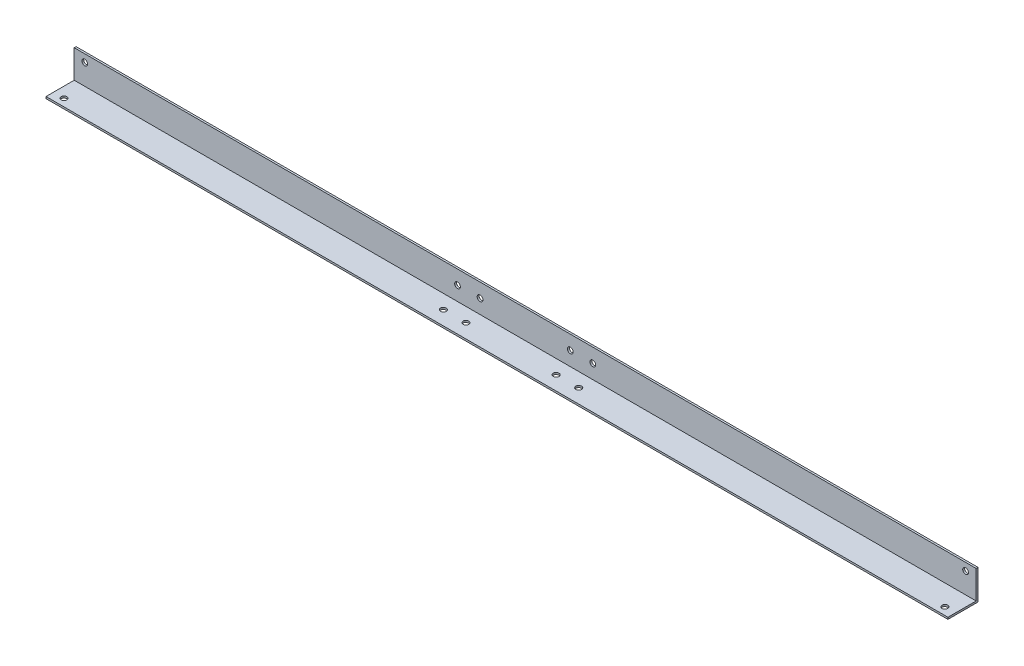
SolidWorks part; units mm, degrees
ref_plane "Front Plane" through (0, 0, 0) normal (1, 0, 0) x (0, 1, 0)
ref_plane "Top Plane" through (0, 0, 0) normal (0, 0, 1) x (0, 1, 0)
ref_plane "Right Plane" through (0, 0, 0) normal (0, 1, 0) x (-1, 0, 0)
sketch "Sketch1" plane through (0, 0, 0) normal (1, 0, 0) x (0, 1, 0)
  line L0 (0, 0) -> (25.4, 0)
  line L1 (0, 0) -> (0, 25.4)
  line L2 (1.5875, 1.5875) -> (1.5875, 25.4)
  line L3 (1.5875, 1.5875) -> (25.4, 1.5875)
  line L4 (25.4, 0) -> (25.4, 1.5875)
  line L5 (0, 25.4) -> (1.5875, 25.4)
  dimension "D1" = 25.4
  dimension "D2" = 1.5875
extrude "Boss-Extrude1" add sketch "Sketch1" along normal mid plane 762
sketch "Sketch2" plane through (0, 0, 0) normal (0, 1, 0) x (-1, 0, 0)
  line L0 (-381, 1.5875) -> (-381, 25.4) construction
  line L1 (-381, 25.4) -> (381, 25.4) construction
  line L2 (0, 13.97) -> (0, -13.97) construction
  circle A0 centre (-372.11, 19.05) radius 2.4257
  circle A2 centre (372.11, 19.05) radius 2.4257
  circle A3 centre (-57.15, 13.4937) radius 2.4257
  circle A4 centre (-38.1, 13.4937) radius 2.4257
  circle A5 centre (57.15, 13.4937) radius 2.4257
  circle A6 centre (38.1, 13.4937) radius 2.4257
  point P15 (-381, 13.4937)
  dimension "D1" = 4.8514
  dimension "D2" = 8.89
  dimension "D3" = 6.35
  dimension "D4" = 4.8514
  dimension "D5" = 4.8514
  dimension "D6" = 38.1
  dimension "D7" = 57.15
extrude "Cut-Extrude1" cut sketch "Sketch2" along normal through all
ref_plane "Plane1" through (0, 0, 0) normal (0, 0.7071, -0.7071) x (0, 0.7071, 0.7071)
mirror "Mirror1" about plane through (0, 0, 0) normal (0, 0.7071, -0.7071) of "Cut-Extrude1"
